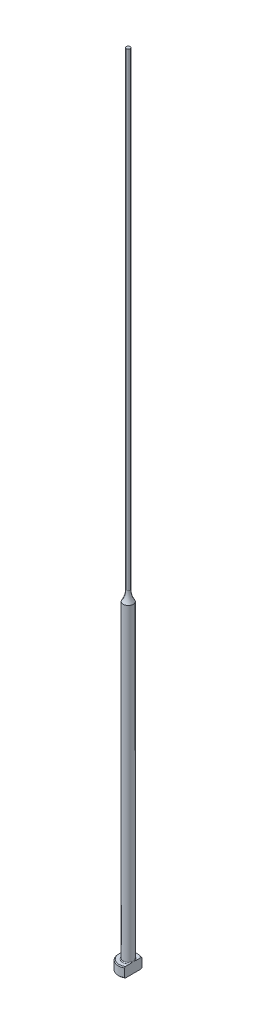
SolidWorks part; units mm, degrees
ref_plane "Front Plane" through (0, 0, 0) normal (0, 0, 1) x (1, 0, 0)
ref_plane "Top Plane" through (0, 0, 0) normal (0, 1, 0) x (1, 0, 0)
ref_plane "Right Plane" through (0, 0, 0) normal (1, 0, 0) x (0, 0, -1)
sketch "Sketch1" plane through (0, 0, 0) normal (0, 0, 1) x (1, 0, 0)
  line L0 (0, 259.9588) -> (0, -15.1925) construction
  line L1 (0, 0) -> (-3.175, 0)
  line L2 (-3.175, 0) -> (-3.175, 3.175)
  line L3 (-3.175, 3.175) -> (-1.5875, 3.175)
  line L4 (-0.5944, 105.0098) -> (-0.5944, 254)
  line L5 (-0.5944, 254) -> (0, 254)
  line L6 (0, 254) -> (0, 0)
  line L7 (-1.5875, 3.175) -> (-1.5875, 101.6)
  arc A0 (-1.5875, 101.6) -> (-0.5944, 105.0098) centre (-6.9444, 105.0098) ccw
  point P13 (-1.5875, 0)
  dimension "D1" = 6.35
  dimension "L" = 254
  dimension "D2" = 3.175
  dimension "H" = 6.35
  dimension "T" = 3.175
  dimension "D" = 1.1887
  dimension "S" = 101.6
revolve "Revolve1" add sketch "Sketch1" angle 360 about L0
chamfer "Chamfer1" distance 0.254 angle 45 2 edges at (0, 3.175, 3.175) (0, 0, 3.175)
fillet "Fillet1" radius 0.254 1 edges at (0, 3.175, 1.5875)
sketch "Sketch2" plane through (0, 0, 0) normal (0, 1, 0) x (1, 0, 0)
  line L0 (1.5875, -2.7496) -> (1.5875, 2.7496)
  circle A0 centre (0, 0) radius 3.175 construction
  arc A2 (1.5875, -2.7496) -> (1.5875, 2.7496) centre (0, 0) ccw
  circle A3 centre (0, 0) radius 3.175 construction
  circle A4 centre (0, 0) radius 1.5875 construction
extrude "Key Head" cut sketch "Sketch2" along normal up to next
